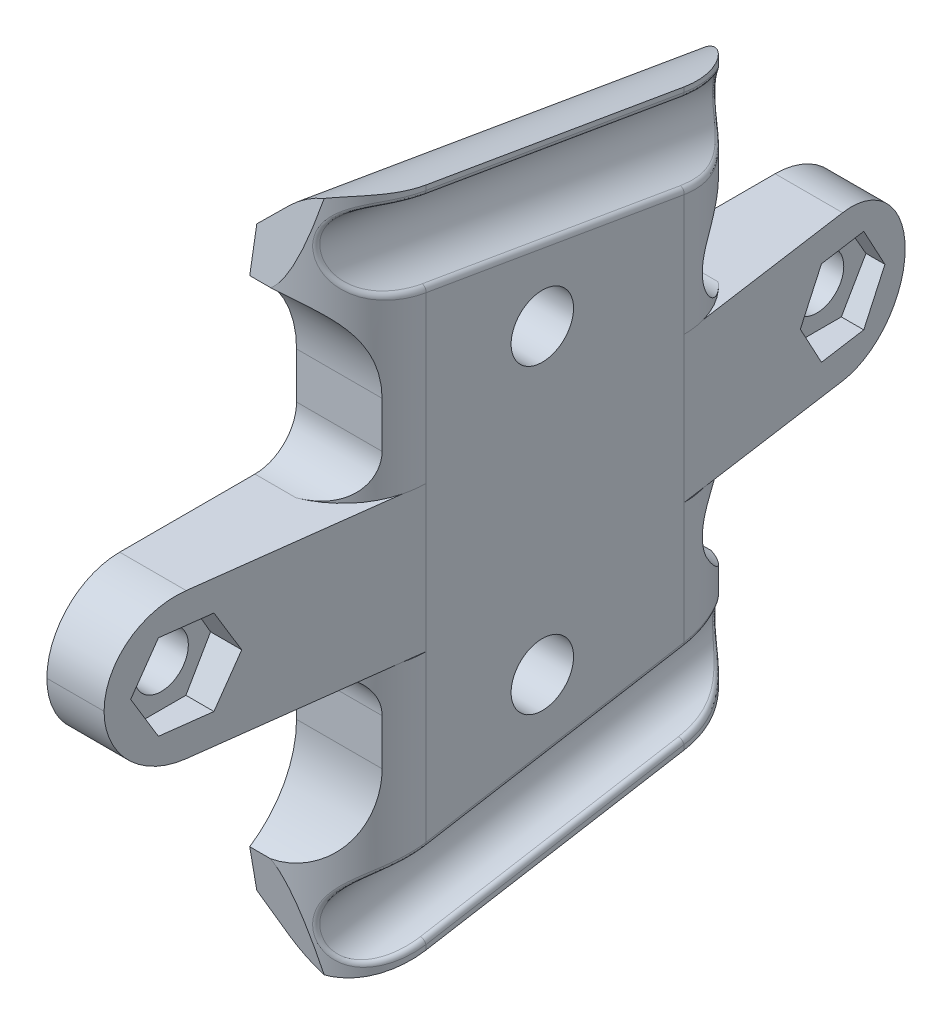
SolidWorks part; units mm, degrees
ref_plane "Front Plane" through (0, 0, 0) normal (1, 0, 0) x (0, 1, 0)
ref_plane "Top Plane" through (0, 0, 0) normal (0, 0, 1) x (0, 1, 0)
ref_plane "Right Plane" through (0, 0, 0) normal (0, 1, 0) x (-1, 0, 0)
sketch "Sketch1" plane through (0, 0, 0) normal (1, 0, 0) x (0, 1, 0)
  line L0 (0, 0) -> (-23, 0)
  line L1 (-23, 0) -> (-23.7692, 4.5)
  line L2 (-23.7692, 4.5) -> (-32.9362, 2.933)
  line L3 (-32.9362, 2.933) -> (-26.0989, -37.067)
  line L4 (-26.0989, -37.067) -> (-16.9319, -35.5)
  line L5 (-16.9319, -35.5) -> (-18, -29.2512)
  line L6 (-18, -29.2512) -> (0, -29.2512)
  line L14 (0, 0) -> (0, -29.2512)
  line L15 (0, -29.2512) -> (0, 57.4431) construction
  dimension "D1" = 9.7
  dimension "D2" = 9.3
  dimension "D3" = 9.3
  dimension "D4" = 40
  dimension "D5" = 18
  dimension "D6" = 4.5
  dimension "D7" = 23
extrude "Boss-Extrude1" add sketch "Sketch1" along normal blind 9
sketch "Sketch2" plane through (0, -1.4221, 8.3199) normal (0, -0.1685, 0.9857) x (1, 0, 0)
  line L0 (9, -22.6712) -> (9, -31.9712) construction
  circle A0 centre (9, -27.3212) radius 3.725
  dimension "D1" = 7.45
extrude "Cut-Extrude1" cut sketch "Sketch2" against normal through all
sketch "Sketch3" plane through (9, 0, 0) normal (1, 0, 0) x (0, 1, 0)
  line L0 (0, -29.2512) -> (0, 0) construction
  circle A0 centre (-14.5, -14.6256) radius 3
  point P4 (0, -14.6256)
  point P5 (-27.7864, -3.984)
  dimension "D1" = 6
  dimension "D2" = 14.5
  dimension "D3" = 0
extrude "Cut-Extrude2" cut sketch "Sketch3" against normal through all
sketch "Sketch4" plane through (0, -1.4221, 8.3199) normal (0, -0.1685, 0.9857) x (1, 0, 0)
  line L0 (9, 0) -> (9, -22.6712) construction
  line L1 (0, -22.6712) -> (-6.1284, -27.8135)
  line L2 (-6.1284, -27.8135) -> (0.0835, -35.2165)
  line L3 (0.0835, -35.2165) -> (9, -31.9712)
  line L4 (0, 0) -> (0, -22.6712) construction
  arc A0 (9, -31.9712) -> (0, -22.6712) centre (9, -22.9663) cw
  dimension "D1" = 130
  dimension "D2" = 250
  dimension "D3" = 8
extrude "Cut-Extrude3" cut sketch "Sketch4" against normal through all
fillet "Fillet1" radius 10 1 edges at (4.5, -23, 0)
fillet "Fillet2" radius 10 1 edges at (4.5, -18, -29.2512)
sketch "Sketch5" plane through (0, 0, 0) normal (-1, 0, 0) x (0, -1, 0)
  line L0 (0, 0) -> (15.4176, 0) construction
  line L1 (14.5, -8.7366) -> (9.4, -11.6811)
  line L2 (9.4, -11.6811) -> (9.4, -17.5701)
  line L3 (9.4, -17.5701) -> (14.5, -20.5146)
  line L4 (14.5, -20.5146) -> (19.6, -17.5701)
  line L5 (19.6, -17.5701) -> (19.6, -11.6811)
  line L6 (19.6, -11.6811) -> (14.5, -8.7366)
  circle A0 centre (14.5, -14.6256) radius 5.1 construction
  dimension "D1" = 10.2
  dimension "D2" = 90
extrude "Cut-Extrude4" cut sketch "Sketch5" against normal blind 4 draft 1
sketch "Sketch6" plane through (0, 5.4152, -31.6801) normal (0, 0.1685, -0.9857) x (1, 0, 0)
  line L0 (2.7378, 29.4372) -> (0, 26.6994)
  line L1 (0, 26.6994) -> (0, 22.6712)
  line L3 (2.7378, 29.4372) -> (0, 22.6712)
  arc A0 (9, 31.9712) -> (0, 23.2615) centre (9, 22.9663) ccw construction
  dimension "D1" = 135
extrude "Boss-Extrude2" add sketch "Sketch6" against normal up to surface (40.5802 mm away)
ref_plane "Plane1" through (0, 0, 0) normal (0, 1, 0) x (1, 0, 0)
mirror "Mirror1" about plane through (9, 0, 0) normal (0, -1, 0)
sketch "Sketch10" plane through (0, 0, 0) normal (0, 1, 0) x (1, 0, 0)
  line L0 (9, -2.933) -> (9, 37.067) construction
  line L1 (0, 36.1787) -> (5.5677, 41.7464)
  line L2 (5.5677, 41.7464) -> (21.0172, 26.2969)
  line L3 (21.0172, 26.2969) -> (11.2978, -7.7211)
  line L4 (11.2978, -7.7211) -> (0, -4.5)
  line L5 (9, 28.2415) -> (9, 3.4373)
  arc A0 (0, -4.5) -> (9, 3.4373) centre (1, 3.4373) ccw
  arc A1 (0, 36.1787) -> (9, 28.2415) centre (1, 28.2415) cw
  dimension "D1" = 8
  dimension "D2" = 8
  dimension "D3" = 11.2978
  dimension "D4" = 9.7194
  dimension "D5" = 34.018
  dimension "D6" = 15.4495
  dimension "D7" = 15.4495
extrude "Cut-Extrude7" cut sketch "Sketch10" against normal through all both and the other way through all
fillet "Fillet3" radius 0.5 7 edges at (9, -28.789, -15.8394) (5.4048, -20.7595, -34.9196) (5.4048, -29.2604, 3.2409) (9, 28.789, -15.8394) (9, 21.2309, -15.8394) (5.3414, 21.031, -34.961) (5.3414, 28.989, 3.2823)
sketch "Sketch8" plane through (0, 0, 0) normal (-1, 0, 0) x (0, -1, 0)
  circle A0 centre (-14.5, -14.6256) radius 6.25
  circle A1 centre (14.5, -14.6256) radius 6.25
  dimension "D1" = 12.5
  dimension "D2" = 12.5
extrude "Cut-Extrude6" cut sketch "Sketch8" against normal blind 4
sketch "Sketch11" plane through (0, 0, 0) normal (-1, 0, 0) x (0, -1, 0)
  line L0 (-7, 0) -> (-7, 24)
  line L1 (-15.4176, 0) -> (15.4176, 0) construction
  line L2 (-7, 24) -> (7, 24)
  line L3 (7, 24) -> (7, 0)
  line L4 (7, 0) -> (7, -53)
  line L5 (7, -53) -> (-7, -53)
  line L6 (-7, -53) -> (-7, 0)
  line L7 (0, 55) -> (0, -55) construction
  circle A0 centre (0, 17) radius 2.6
  circle A1 centre (0, -46) radius 2.6
  dimension "D5" = 63
  dimension "D6" = 7
  dimension "D4" = 7
  dimension "D7" = 5.2
  dimension "D8" = 5.2
  dimension "D1" = 14
  dimension "D2" = 7
  dimension "D3" = 24
extrude "Boss-Extrude3" add sketch "Sketch11" against normal blind 9
fillet "Fillet4" radius 4 11 edges at (4.468, 7.6621, -29.2512) (4.468, -7.6621, -29.2512) (8.936, 7.3311, -29.2512) (8.3821, -13.7585, -31.3244) (8.936, -7.3311, -29.2512) (0, 7.3311, -29.2512) (4.468, 7, -29.2512) (4.112, 7, 0) (4.468, -7, -29.2512) (4.112, -7, 0) (0, -7.3311, -29.2512)
fillet "Fillet5" radius 7 4 edges at (4.5, -7, -53) (4.5, 7, -53) (4.5, 7, 24) (4.5, -7, 24)
sketch "Sketch12" plane through (9, 0, 0) normal (1, 0, 0) x (0, 1, 0)
  line L0 (7, -3.4373) -> (22.8737, -3.4373) construction
  line L1 (0, 21.7343) -> (-4.1, 19.3671)
  line L2 (-4.1, 19.3671) -> (-4.1, 14.6329)
  line L3 (-4.1, 14.6329) -> (0, 12.2657)
  line L4 (0, 12.2657) -> (4.1, 14.6329)
  line L5 (4.1, 14.6329) -> (4.1, 19.3671)
  line L6 (4.1, 19.3671) -> (0, 21.7343)
  line L7 (0, -41.2657) -> (-4.1, -43.6329)
  line L8 (-4.1, -43.6329) -> (-4.1, -48.3671)
  line L9 (-4.1, -48.3671) -> (0, -50.7343)
  line L10 (0, -50.7343) -> (4.1, -48.3671)
  line L11 (4.1, -48.3671) -> (4.1, -43.6329)
  line L12 (4.1, -43.6329) -> (0, -41.2657)
  line L13 (7, -28.2415) -> (18.6339, -28.2415) construction
  circle A0 centre (0, 17) radius 4.1 construction
  circle A1 centre (0, -46) radius 4.1 construction
  dimension "D1" = 8.2
  dimension "D2" = 8.2
  dimension "D3" = 90
  dimension "D4" = 90
extrude "Cut-Extrude8" cut sketch "Sketch12" against normal blind 5 and the other way through all
sketch "Sketch13" plane through (0, -7, 0) normal (0, -1, 0) x (1, 0, 0)
  line L0 (9, -3.4373) -> (5.5, 24)
  line L1 (0, 24) -> (9, 24) construction
  line L2 (5.5, 24) -> (10, 24)
  line L3 (10, 24) -> (10, -53)
  line L4 (0, -53) -> (9, -53) construction
  line L5 (5.5, -53) -> (9, -28.2415)
  line L6 (9, -28.2415) -> (9, -3.4373)
  line L7 (9, 17) -> (9, 24) construction
  line L8 (9, -53) -> (9, -46) construction
  line L9 (5.5, -53) -> (10, -53)
  point P7 (10, -53.438)
  dimension "D3" = 3.5
  dimension "D1" = 3.5
  dimension "D2" = 1
extrude "Cut-Extrude9" cut sketch "Sketch13" against normal up to surface (14 mm away)
